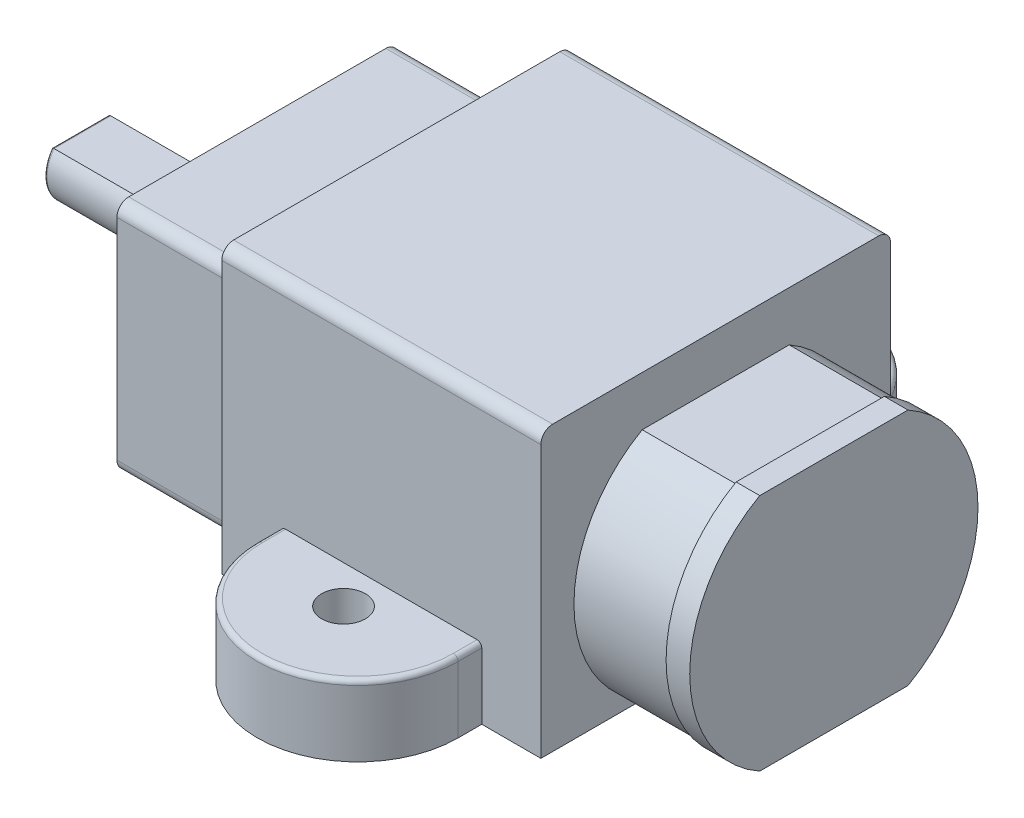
SolidWorks part; units mm, degrees
ref_plane "Plan de face" through (0, 0, 0) normal (0, 0, 1) x (1, 0, 0)
ref_plane "Plan de dessus" through (0, 0, 0) normal (0, 1, 0) x (1, 0, 0)
ref_plane "Plan de droite" through (0, 0, 0) normal (1, 0, 0) x (0, 0, -1)
sketch "Esquisse1" plane through (0, 0, 0) normal (0, 1, 0) x (1, 0, 0)
  line L1 (0, 0) -> (13.5, 0)
  line L2 (0, 0) -> (0, 14.8)
  line L3 (0, 14.8) -> (13.5, 14.8)
  line L4 (13.5, 0) -> (13.5, 14.8)
  dimension "D1" = 13.5
  dimension "D2" = 14.8
extrude "Extrusion1" add sketch "Esquisse1" along normal blind 12
fillet "Congé1" radius 0.5 2 edges at (6.75, 12, -14.8) (6.75, 12, 0)
sketch "Esquisse2" plane through (0, 0, 0) normal (0, -1, 0) x (1, 0, 0)
  line L0 (6.75, 0) -> (6.75, 5.3037) construction
  line L1 (0, 0) -> (13.5, 0) construction
  line L2 (2.5, 0) -> (2.5, 1)
  line L3 (11, 0) -> (11, 1)
  line L4 (2.5, -14.8) -> (11, -14.8)
  line L5 (13.5, -7.4) -> (4.5137, -7.4) construction
  line L6 (13.5, 0) -> (13.5, -14.8) construction
  line L7 (11, -14.8) -> (11, -15.8)
  line L8 (2.5, -14.8) -> (2.5, -15.8)
  line L9 (6.75, 5.25) -> (-2.7613, 5.25) construction
  line L11 (2.5, 0) -> (11, 0)
  circle A0 centre (6.75, 1.6) radius 0.925
  circle A1 centre (6.75, -16.4) radius 0.925
  arc A2 (2.5, -15.8) -> (11, -15.8) centre (6.75, -15.8) ccw
  arc A3 (2.5, 1) -> (11, 1) centre (6.75, 1) cw
  dimension "D1" = 1.85
  dimension "D3" = 1
  dimension "D4" = 5.25
  dimension "D2" = 1.6
extrude "Extrusion2" add sketch "Esquisse2" against normal blind 3
fillet "Congé3" radius 0.2 6 edges at (6.75, 3, 5.25) (11, 3, 0.5) (2.5, 3, 0.5) (6.75, 3, -20.05) (2.5, 3, -15.3) (11, 3, -15.3)
sketch "Esquisse3" plane through (0, 0, 0) normal (-1, 0, 0) x (0, 0, 1)
  line L0 (-7.4, 0) -> (-7.4, 10.0838) construction
  line L1 (-14.8, 0) -> (0, 0) construction
  line L2 (-7.4, 9.9) -> (-7.4, 0) construction
  line L3 (-12.84, 9.9) -> (-1.96, 9.9)
  line L4 (-13.34, 9.4) -> (-13.34, 0.5)
  line L5 (-12.84, 0) -> (-1.96, 0)
  line L6 (-1.46, 9.4) -> (-1.46, 0.5)
  arc A0 (-12.84, 9.9) -> (-13.34, 9.4) centre (-12.84, 9.4) ccw
  arc A1 (-1.46, 9.4) -> (-1.96, 9.9) centre (-1.96, 9.4) ccw
  arc A2 (-1.96, 0) -> (-1.46, 0.5) centre (-1.96, 0.5) ccw
  arc A3 (-12.84, 0) -> (-13.34, 0.5) centre (-12.84, 0.5) cw
  point P12 (-13.34, 9.9)
  point P15 (-1.46, 9.9)
  point P18 (-1.46, 0)
  dimension "D3" = 0.5
  dimension "D1" = 11.88
  dimension "D2" = 9.9
extrude "Extrusion3" add sketch "Esquisse3" along normal blind 5.9
sketch "Esquisse4" plane through (-5.9, 0, 0) normal (-1, 0, 0) x (0, 0, 1)
  line L0 (-7.4, 9.9) -> (-7.4, 0) construction
  line L1 (-1.96, 9.9) -> (-12.84, 9.9) construction
  line L2 (-12.84, 0) -> (-1.96, 0) construction
  circle A0 centre (-7.4, 4.95) radius 2
extrude "Extrusion4" add sketch "Esquisse4" along normal blind 0.5
sketch "Esquisse5" plane through (-6.4, 0, 0) normal (-1, 0, 0) x (0, 0, 1)
  line L0 (-8.6, 5.85) -> (-6.2, 5.85)
  arc A1 (-8.6, 5.85) -> (-6.2, 5.85) centre (-7.4, 4.95) ccw
extrude "Extrusion5" add sketch "Esquisse5" along normal blind 7
sketch "Esquisse6" plane through (-6.4, 0, 0) normal (-1, 0, 0) x (0, 0, 1)
  circle A0 centre (-7.4, 4.95) radius 1.5
extrude "Extrusion6" add sketch "Esquisse6" along normal blind 0.2
fillet "Congé4" radius 0.1 2 edges at (-13.4, 3.45, -7.4) (-13.4, 5.85, -7.4)
sketch "Esquisse7" plane through (13.5, 0, 0) normal (1, 0, 0) x (0, 0, -1)
  line L0 (7.4, 0) -> (7.4, 10.2575) construction
  line L1 (0, 0) -> (14.8, 0) construction
  line L2 (7.4, 9.9) -> (7.4, 0) construction
  line L7 (13.4, 4.95) -> (1.4, 4.95) construction
  line L8 (4.2894, 9.9) -> (10.5106, 9.9)
  line L9 (4.2894, 0) -> (10.5106, 0)
  arc A0 (4.2894, 9.9) -> (4.2894, 0) centre (7.0848, 4.95) ccw
  arc A1 (10.5106, 9.9) -> (10.5106, 0) centre (7.7152, 4.95) cw
extrude "Extrusion7" add sketch "Esquisse7" along normal blind 4
sketch "Esquisse8" plane through (17.5, 0, 0) normal (1, 0, 0) x (0, 0, -1)
  line L4 (4.2632, -0.1) -> (10.5368, -0.1)
  line L5 (10.5368, 10) -> (4.2632, 10)
  line L6 (4.2632, -0.1) -> (10.5368, -0.1)
  line L7 (10.5368, 10) -> (4.2632, 10)
  arc A4 (4.2632, 10) -> (4.2632, -0.1) centre (7.0848, 4.95) ccw
  arc A5 (10.5368, -0.1) -> (10.5368, 10) centre (7.7152, 4.95) ccw
  arc A6 (4.2632, 10) -> (4.2632, -0.1) centre (7.0848, 4.95) ccw
  arc A7 (10.5368, -0.1) -> (10.5368, 10) centre (7.7152, 4.95) ccw
  dimension "D1" = 0.1
extrude "Extrusion8" add sketch "Esquisse8" along normal blind 1
